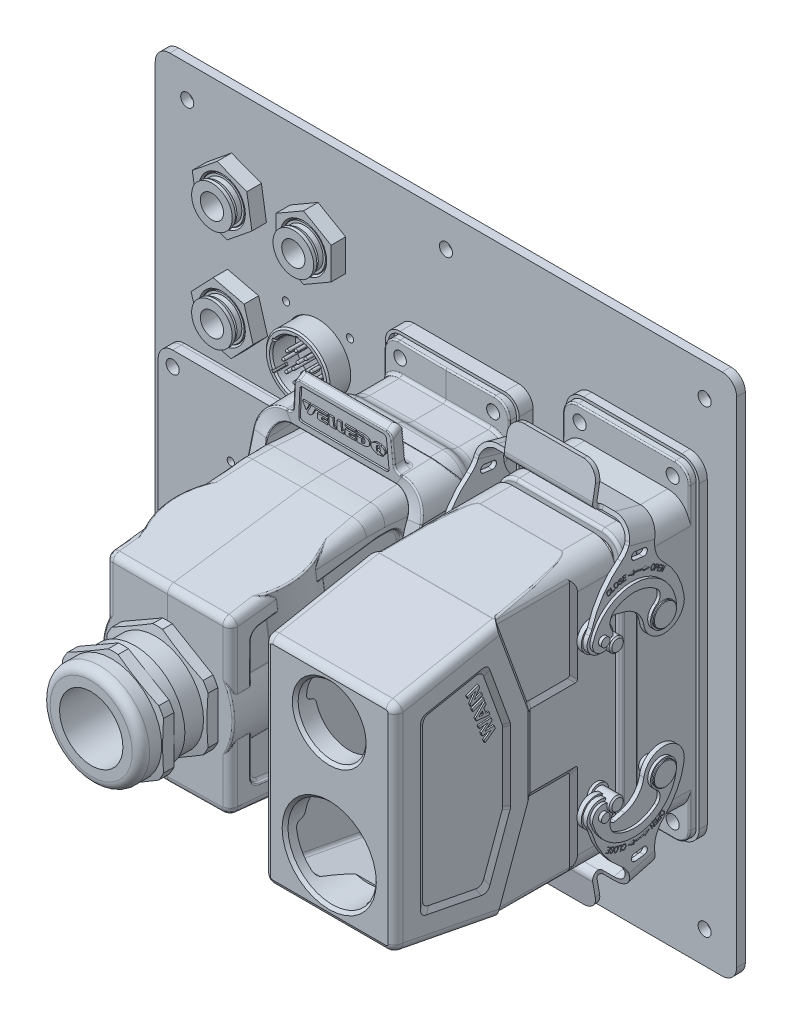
SolidWorks part; units mm, degrees
other "NONE"
ref_plane "前视基准面" through (0, 0, 0) normal (0, 0, 1) x (1, 0, 0)
ref_plane "上视基准面" through (0, 0, 0) normal (0, 1, 0) x (1, 0, 0)
ref_plane "右视基准面" through (0, 0, 0) normal (1, 0, 0) x (0, 0, -1)
imported_body "曲面-输入1"
imported_body "曲面-输入2"
imported_body "曲面-输入3"
imported_body "曲面-输入4"
imported_body "曲面-输入5"
imported_body "曲面-输入6"
imported_body "曲面-输入7"
imported_body "曲面-输入8"
imported_body "曲面-输入9"
imported_body "曲面-输入10"
imported_body "输入1"
imported_body "输入2"
imported_body "输入3"
imported_body "输入4"
imported_body "输入5"
imported_body "输入6"
imported_body "输入7"
imported_body "输入8"
imported_body "输入9"
imported_body "输入10"
imported_body "输入11"
imported_body "输入12"
imported_body "输入13"
imported_body "输入14"
imported_body "输入15"
imported_body "输入16"
imported_body "输入17"
imported_body "输入18"
imported_body "输入19"
imported_body "输入20"
imported_body "输入21"
imported_body "输入22"
imported_body "输入23"
imported_body "输入24"
imported_body "输入25"
imported_body "输入26"
imported_body "输入27"
imported_body "输入28"
imported_body "输入29"
imported_body "输入30"
imported_body "输入31"
imported_body "输入32"
imported_body "输入33"
imported_body "输入34"
imported_body "输入35"
imported_body "输入36"
imported_body "输入37"
imported_body "输入38"
imported_body "输入39"
imported_body "输入40"
imported_body "输入41"
imported_body "输入42"
imported_body "输入43"
imported_body "输入44"
imported_body "输入45"
imported_body "输入46"
imported_body "输入47"
imported_body "输入48"
imported_body "输入49"
imported_body "输入50"
imported_body "输入51"
imported_body "输入52"
imported_body "输入53"
imported_body "输入54"
imported_body "输入55"
imported_body "输入56"
imported_body "输入57"
imported_body "输入58"
imported_body "输入59"
imported_body "输入60"
imported_body "输入61"
imported_body "输入62"
imported_body "输入63"
imported_body "输入64"
imported_body "输入65"
imported_body "输入66"
imported_body "输入67"
imported_body "输入68"
imported_body "输入69"
imported_body "输入70"
imported_body "输入71"
imported_body "输入72"
imported_body "输入73"
imported_body "输入74"
imported_body "输入75"
imported_body "输入76"
imported_body "输入77"
imported_body "输入78"
imported_body "输入79"
imported_body "输入80"
imported_body "输入81"
imported_body "输入82"
imported_body "输入83"
imported_body "输入84"
imported_body "输入85"
imported_body "输入86"
imported_body "输入87"
imported_body "输入88"
imported_body "输入89"
imported_body "输入90"
imported_body "输入91"
imported_body "输入92"
imported_body "输入93"
imported_body "输入94"
imported_body "输入95"
imported_body "输入96"
imported_body "输入97"
imported_body "输入98"
imported_body "输入99"
imported_body "输入100"
imported_body "输入101"
imported_body "输入102"
imported_body "输入103"
imported_body "输入104"
imported_body "输入105"
imported_body "输入106"
imported_body "输入107"
imported_body "输入108"
imported_body "输入109"
imported_body "输入110"
imported_body "输入111"
imported_body "输入112"
imported_body "输入113"
imported_body "输入114"
imported_body "输入115"
imported_body "输入116"
imported_body "输入117"
imported_body "输入118"
imported_body "输入119"
imported_body "输入120"
imported_body "输入121"
imported_body "输入122"
imported_body "输入123"
imported_body "输入124"
imported_body "输入125"
imported_body "输入126"
imported_body "输入127"
imported_body "输入128"
imported_body "输入129"
imported_body "输入130"
imported_body "输入131"
imported_body "输入132"
imported_body "输入133"
imported_body "输入134"
imported_body "输入135"
imported_body "输入136"
imported_body "输入137"
imported_body "输入138"
imported_body "输入139"
imported_body "输入140"
imported_body "输入141"
imported_body "输入142"
imported_body "输入143"
imported_body "输入144"
imported_body "输入145"
imported_body "输入146"
imported_body "输入147"
imported_body "输入148"
imported_body "输入149"
imported_body "输入150"
imported_body "输入151"
imported_body "输入152"
delete or keep bodies "实体-删除/保留 1" type delete bodies bodies 223 242 266 244 220 228 227 211 235 224 230 234 245 209 231 226 215 213 217 222 241 267 233 210 218 236 240 268 175 243 216 207 229 214 225 238 208 221 176 232
delete or keep bodies "实体-删除/保留 2" type delete bodies bodies 237 257 264 262 263 261 260 259 258 256 255 254 253 252 251 250 249 248 247 246 265 219 212 193 194 198 195 196 197 199 200 201 202 203 204 205 206 177 178 179
delete or keep bodies "实体-删除/保留 3" type delete bodies bodies 122
delete or keep bodies "实体-删除/保留 4" type delete bodies bodies 270
